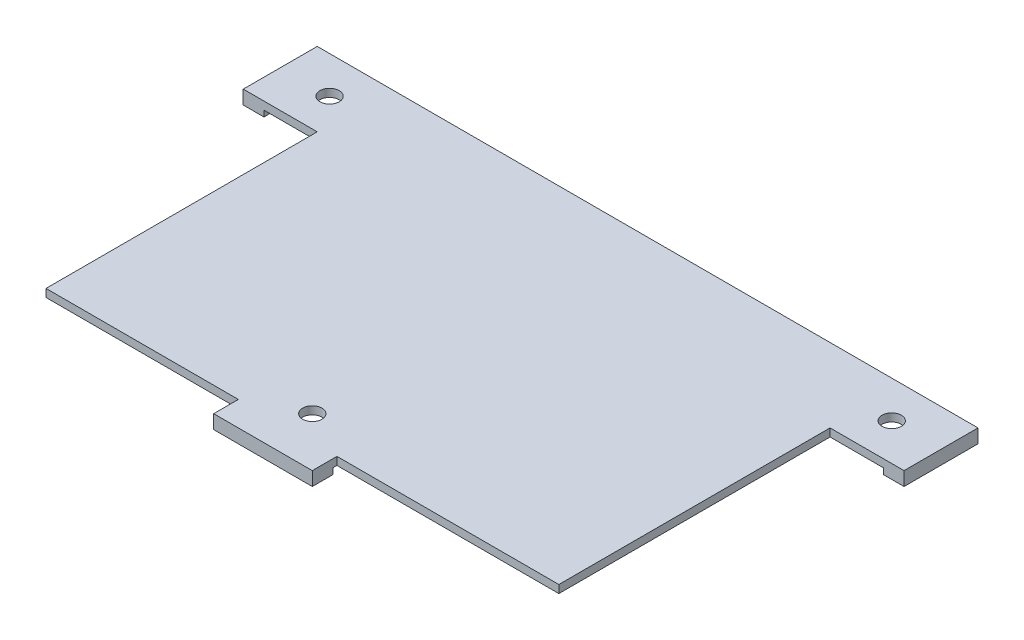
SolidWorks part; units mm, degrees
ref_plane "Plane XZ" through (0, 0, 0) normal (0, 0, 1) x (1, 0, 0)
ref_plane "Plane XY" through (0, 0, 0) normal (0, 1, 0) x (1, 0, 0)
ref_plane "Plane YZ" through (0, 0, 0) normal (1, 0, 0) x (0, 0, -1)
sketch "Sketch1" plane through (0, 0, 0) normal (0, 1, 0) x (1, 0, 0)
  line L0 (0, 36.5125) -> (0, 0) construction
  line L1 (-37.465, 41.275) -> (41.275, 41.275)
  line L2 (-37.465, 41.275) -> (-37.465, -3.175)
  line L3 (-37.465, -3.175) -> (41.275, -3.175)
  line L4 (41.275, 41.275) -> (41.275, -3.175)
  line L5 (-34.29, 36.5125) -> (38.1, 36.5125) construction
  line L6 (-34.29, 36.5125) -> (-34.29, 0) construction
  line L7 (-34.29, 0) -> (38.1, 0) construction
  line L8 (38.1, 36.5125) -> (38.1, 0) construction
  circle A0 centre (-34.29, 36.5125) radius 1.2446
  circle A1 centre (0, 0) radius 1.2446
  circle A2 centre (38.1, 36.5125) radius 1.2446
  dimension "D8" = 2.4892
  dimension "D1" = 34.29
  dimension "D2" = 38.1
  dimension "D3" = 36.5125
  dimension "D4" = 4.7625
  dimension "D5" = 3.175
  dimension "D6" = 3.175
  dimension "D7" = 3.175
extrude "Boss-Extrude1" add sketch "Sketch1" along normal blind 1.016
sketch "Sketch2" plane through (0, 1.016, 0) normal (0, 1, 0) x (1, 0, 0)
  line L0 (-37.465, -3.175) -> (41.275, -3.175) construction
  line L1 (-37.465, 41.275) -> (-40.64, 41.275)
  line L2 (-37.465, 41.275) -> (-37.465, 31.75)
  line L3 (-37.465, 31.75) -> (-40.64, 31.75)
  line L4 (-40.64, 41.275) -> (-40.64, 31.75)
  line L5 (-6.35, -3.175) -> (6.35, -3.175)
  line L6 (-6.35, -3.175) -> (-6.35, -6.35)
  line L7 (-6.35, -6.35) -> (6.35, -6.35)
  line L8 (6.35, -3.175) -> (6.35, -6.35)
  line L9 (0, 0) -> (0, -3.175) construction
  line L10 (41.275, 41.275) -> (44.45, 41.275)
  line L11 (41.275, 41.275) -> (41.275, 31.75)
  line L12 (41.275, 31.75) -> (44.45, 31.75)
  line L13 (44.45, 41.275) -> (44.45, 31.75)
  dimension "D1" = 9.525
  dimension "D2" = 12.7
  dimension "D3" = 3.175
extrude "Boss-Extrude2" add sketch "Sketch2" against normal offset from surface (1.778 mm away) 0.762
sketch "Sketch3" plane through (0, -0.762, 0) normal (0, -1, 0) x (1, 0, 0)
  line L0 (44.45, -31.75) -> (41.275, -31.75) construction
  line L1 (41.275, -41.275) -> (41.783, -41.275)
  line L2 (41.275, -41.275) -> (41.275, -31.75)
  line L3 (41.275, -31.75) -> (41.783, -31.75)
  line L4 (41.783, -41.275) -> (41.783, -31.75)
  line L5 (-37.465, -31.75) -> (-40.64, -31.75) construction
  line L6 (-37.465, -41.275) -> (-37.973, -41.275)
  line L7 (-37.465, -41.275) -> (-37.465, -31.75)
  line L8 (-37.465, -31.75) -> (-37.973, -31.75)
  line L9 (-37.973, -41.275) -> (-37.973, -31.75)
  line L10 (-6.35, 6.35) -> (-6.35, 3.175) construction
  line L11 (6.35, 3.175) -> (-6.35, 3.175)
  line L12 (6.35, 3.175) -> (6.35, 3.683)
  line L13 (6.35, 3.683) -> (-6.35, 3.683)
  line L14 (-6.35, 3.175) -> (-6.35, 3.683)
  dimension "D1" = 0.508
extrude "Cut-Extrude1" cut sketch "Sketch3" against normal up to surface (0.762 mm away)
sketch "Sketch4" plane through (0, 1.016, 0) normal (0, 1, 0) x (1, 0, 0)
  line L0 (-40.64, 31.75) -> (-37.465, 31.75) construction
  line L1 (-37.465, -3.175) -> (-31.115, -3.175)
  line L2 (-37.465, -3.175) -> (-37.465, 31.75)
  line L3 (-37.465, 31.75) -> (-31.115, 31.75)
  line L4 (-31.115, -3.175) -> (-31.115, 31.75)
  line L5 (41.275, -3.175) -> (34.925, -3.175)
  line L6 (41.275, -3.175) -> (41.275, 31.75)
  line L7 (41.275, 31.75) -> (34.925, 31.75)
  line L8 (34.925, -3.175) -> (34.925, 31.75)
  line L9 (41.275, 31.75) -> (44.45, 31.75) construction
  circle A0 centre (38.1, 36.5125) radius 1.2446 construction
  circle A1 centre (-34.29, 36.5125) radius 1.2446 construction
  dimension "D1" = 3.175
  dimension "D2" = 3.175
extrude "Cut-Extrude2" cut sketch "Sketch4" against normal through all
sketch "Sketch5" plane through (0, 0, 0) normal (0, -1, 0) x (1, 0, 0)
  line L0 (0, 0) -> (0, -15.875) construction
  line L1 (16.7157, -15.875) -> (-16.7157, -15.875) construction
  text T0 "<b>V1</b>" font "Calibri" height 12.7
  dimension "D1" = 15.875
extrude "Cut-Extrude3" cut sketch "Sketch5" against normal blind 0.508
